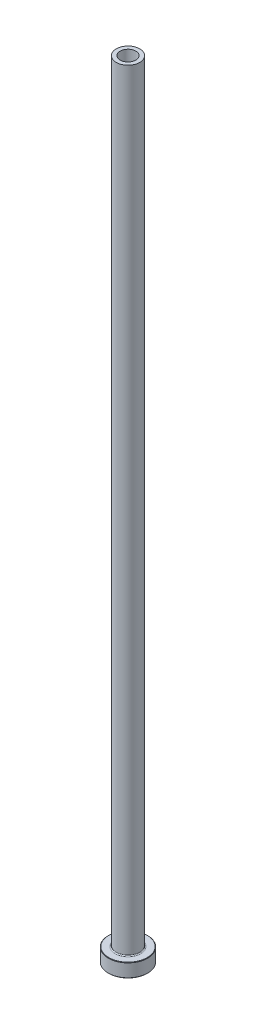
SolidWorks part; units mm, degrees
ref_plane "Front Plane" through (0, 0, 0) normal (0, 0, 1) x (1, 0, 0)
ref_plane "Top Plane" through (0, 0, 0) normal (0, 1, 0) x (1, 0, 0)
ref_plane "Right Plane" through (0, 0, 0) normal (1, 0, 0) x (0, 0, -1)
sketch "Sketch1" plane through (0, 0, 0) normal (0, 0, 1) x (1, 0, 0)
  line L0 (-4, 400) -> (-6, 400)
  line L1 (-6, 400) -> (-6, 7)
  line L2 (-6, 7) -> (-10, 7)
  line L3 (-10, 7) -> (-10, 0)
  line L4 (11, 0) -> (-11, 0) construction
  line L5 (-10, 0) -> (-4.25, 0)
  line L6 (-4, 355) -> (-4, 400)
  line L7 (0, 92.1877) -> (0, -15.5353) construction
  line L8 (0, -11) -> (0, 11) construction
  line L9 (-4, 355) -> (-4.25, 343)
  line L10 (-4.25, 343) -> (-4.25, 0)
  dimension "D1" = 0.25
  dimension "ID" = 8
  dimension "OD" = 12
  dimension "L" = 400
  dimension "H" = 20
  dimension "T" = 7
  dimension "N" = 45
  dimension "D2" = 12
revolve "Revolve1" add sketch "Sketch1" angle 360 about L7
fillet "Fillet1" radius 0.5 1 edges at (0, 7, 6)
chamfer "Chamfer1" distance 0.2 angle 45 2 edges at (0, 7, 10) (0, 0, 10)
chamfer "Chamfer3" distance 0.5 angle 45 1 edges at (0, 0, 4.25)
